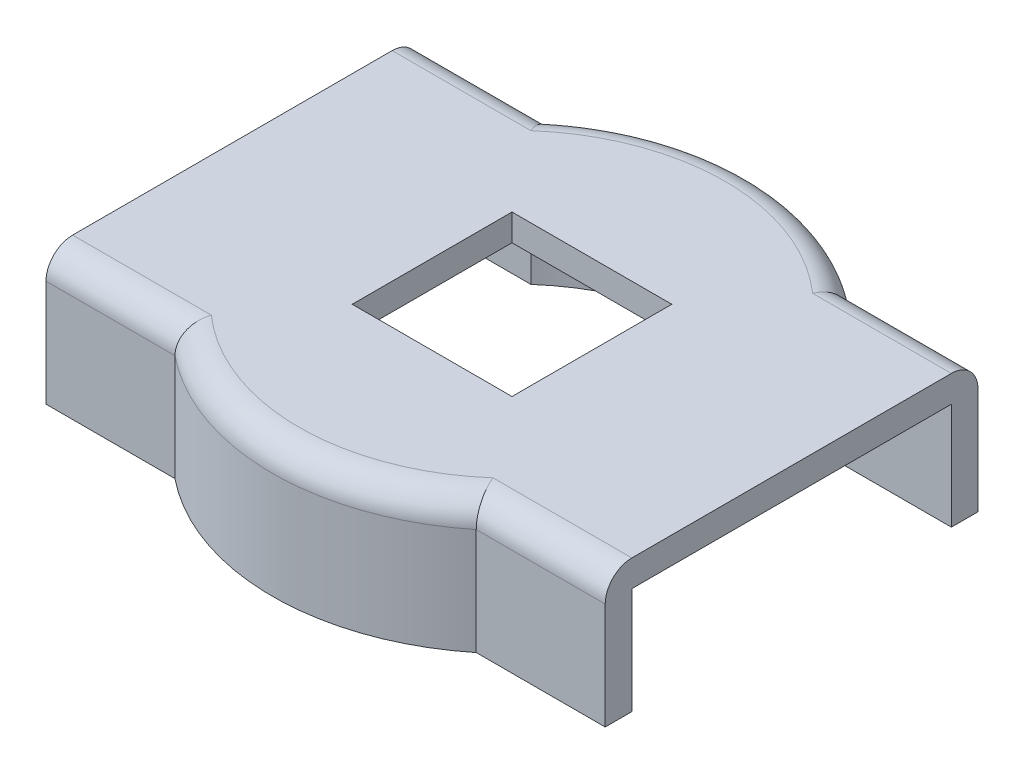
SolidWorks part; units mm, degrees
ref_plane "Front Plane" through (0, 0, 0) normal (0, 0, 1) x (1, 0, 0)
ref_plane "Top Plane" through (0, 0, 0) normal (0, 1, 0) x (1, 0, 0)
ref_plane "Right Plane" through (0, 0, 0) normal (1, 0, 0) x (0, 0, -1)
mirrored part "Крепление седла_Зеркально отражен"
other "<Крепление седла>-<Оболочка1>"
